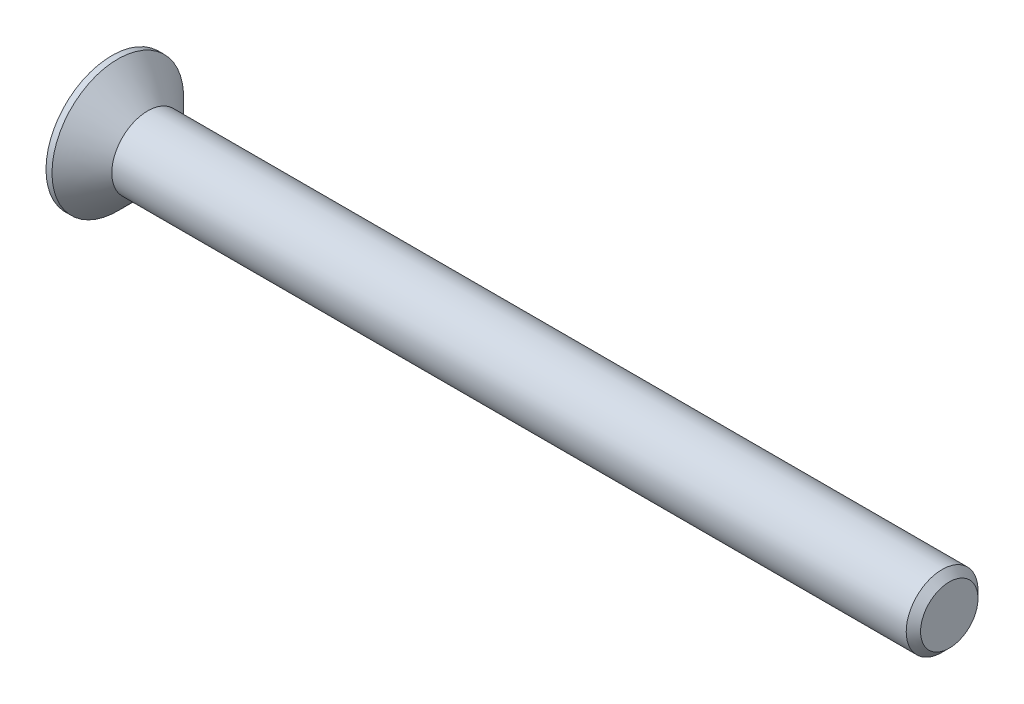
SolidWorks part; units mm, degrees
ref_plane "Front Plane" through (0, 0, 0) normal (0, 0, 1) x (1, 0, 0)
ref_plane "Top Plane" through (0, 0, 0) normal (0, 1, 0) x (1, 0, 0)
ref_plane "Right Plane" through (0, 0, 0) normal (1, 0, 0) x (0, 0, -1)
sketch "Sketch1" plane through (0, 0, 0) normal (0, 0, 1) x (1, 0, 0)
  line L1 (-3, 5.5) -> (-3, 0)
  line L2 (-3, 0) -> (67, 0)
  line L3 (67, 0) -> (67, 3)
  line L4 (67, 3) -> (0, 3)
  line L5 (-3, 5.5) -> (-2.5, 5.5)
  line L6 (-2.5, 5.5) -> (0, 3)
  dimension "D1" = 3
  dimension "D2" = 45
  dimension "D3" = 3
  dimension "D4" = 70
  dimension "D5" = 5.5
revolve "Revolve1" add sketch "Sketch1" angle 360 about L2
chamfer "Chamfer1" distance 0.6 angle 45 1 edges at (67, 0, 3)
sketch "Sketch2" plane through (-3, 0, 0) normal (-1, 0, 0) x (0, 0, 1)
  line L0 (-0.825, 3.3) -> (0.825, 3.3)
  line L1 (0.825, 3.3) -> (0.825, 0.825)
  line L2 (0.825, 0.825) -> (3.3, 0.825)
  line L3 (3.3, 0.825) -> (3.3, -0.825)
  line L4 (3.3, -0.825) -> (0.825, -0.825)
  line L5 (0.825, -0.825) -> (0.825, -3.3)
  line L6 (0.825, -3.3) -> (-0.825, -3.3)
  line L7 (-0.825, -3.3) -> (-0.825, -0.825)
  line L8 (-0.825, -0.825) -> (-3.3, -0.825)
  line L9 (-3.3, -0.825) -> (-3.3, 0.825)
  line L10 (-3.3, 0.825) -> (-0.825, 0.825)
  line L11 (-0.825, 0.825) -> (-0.825, 3.3)
  point P2 (0, 3.3)
  point P14 (0, -3.3)
  point P15 (3.3, 0)
  point P16 (-3.3, 0)
  dimension "D1" = 6.6
  dimension "D2" = 1.65
extrude "Cut-Extrude1" cut sketch "Sketch2" against normal blind 2.5
